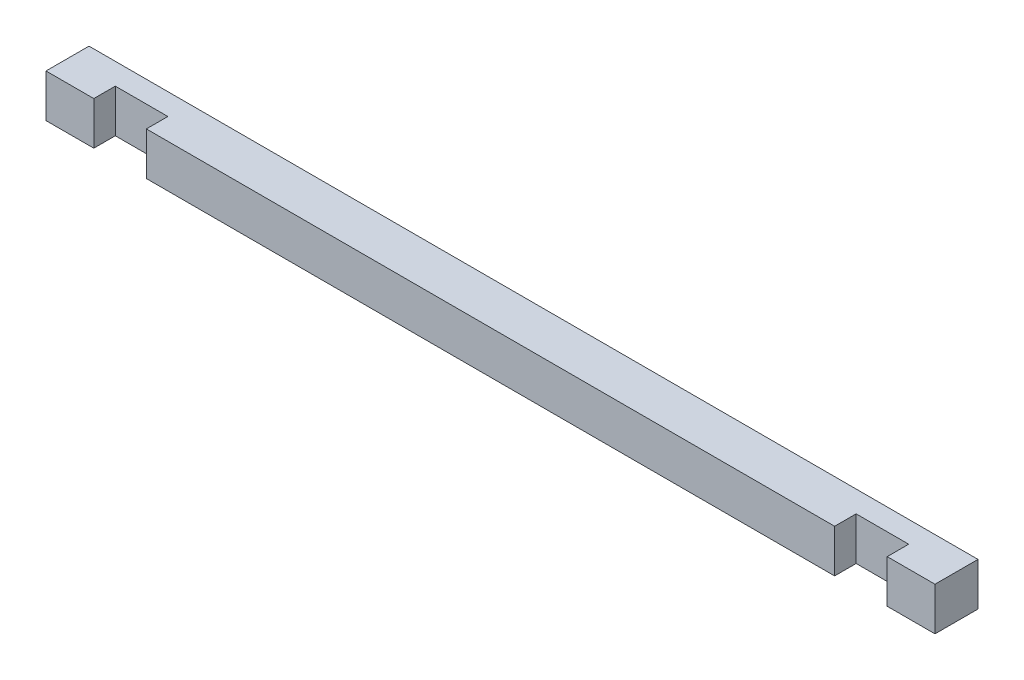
SolidWorks part; units mm, degrees
ref_plane "Plan de face" through (0, 0, 0) normal (0, 0, 1) x (1, 0, 0)
ref_plane "Plan de dessus" through (0, 0, 0) normal (0, 1, 0) x (1, 0, 0)
ref_plane "Plan de droite" through (0, 0, 0) normal (1, 0, 0) x (0, 0, -1)
sketch "Esquisse1" plane through (0, 0, 0) normal (0, 0, 1) x (1, 0, 0)
  line L1 (0, 0) -> (186, 0)
  line L2 (0, 0) -> (0, 9)
  line L3 (0, 9) -> (186, 9)
  line L4 (186, 0) -> (186, 9)
  dimension "D1" = 186
  dimension "D2" = 9
extrude "Extrusion1" add sketch "Esquisse1" along normal blind 9
sketch "Esquisse2" plane through (0, 0, 9) normal (0, 0, 1) x (1, 0, 0)
  line L0 (0, 0) -> (186, 0) construction
  line L1 (165, 0) -> (176, 0)
  line L2 (165, 0) -> (165, 9)
  line L3 (165, 9) -> (176, 9)
  line L4 (176, 0) -> (176, 9)
  line L5 (186, 9) -> (0, 9) construction
  line L7 (10, 0) -> (21, 0)
  line L8 (10, 0) -> (10, 9)
  line L9 (10, 9) -> (21, 9)
  line L10 (21, 0) -> (21, 9)
  dimension "D1" = 11
  dimension "D2" = 11
  dimension "D3" = 10
  dimension "D4" = 10
extrude "Enlèv. mat.-Extru.1" cut sketch "Esquisse2" against normal blind 4.5
